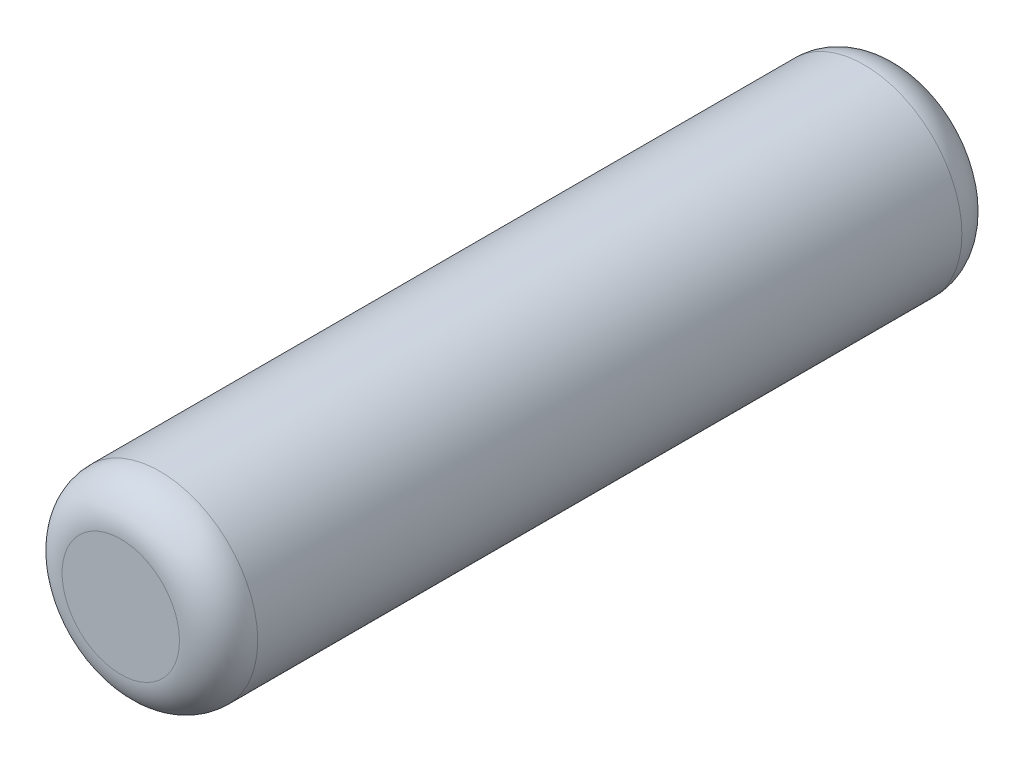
SolidWorks part; units mm, degrees
ref_plane "Plan1" through (0, 0, 0) normal (0, 0, 1) x (1, 0, 0)
ref_plane "Plan2" through (0, 0, 0) normal (0, 1, 0) x (1, 0, 0)
ref_plane "Plan3" through (0, 0, 0) normal (1, 0, 0) x (0, 0, -1)
sketch "Esquisse1" plane through (0, 0, 0) normal (0, 0, 1) x (1, 0, 0)
  circle A0 centre (0, 0) radius 2.5
  dimension "D1" = 5
extrude "Base-Extrusion" add sketch "Esquisse1" along normal blind 20
fillet "Congé1" radius 1 2 edges at (2.5, 0, 0) (2.5, 0, 20)
